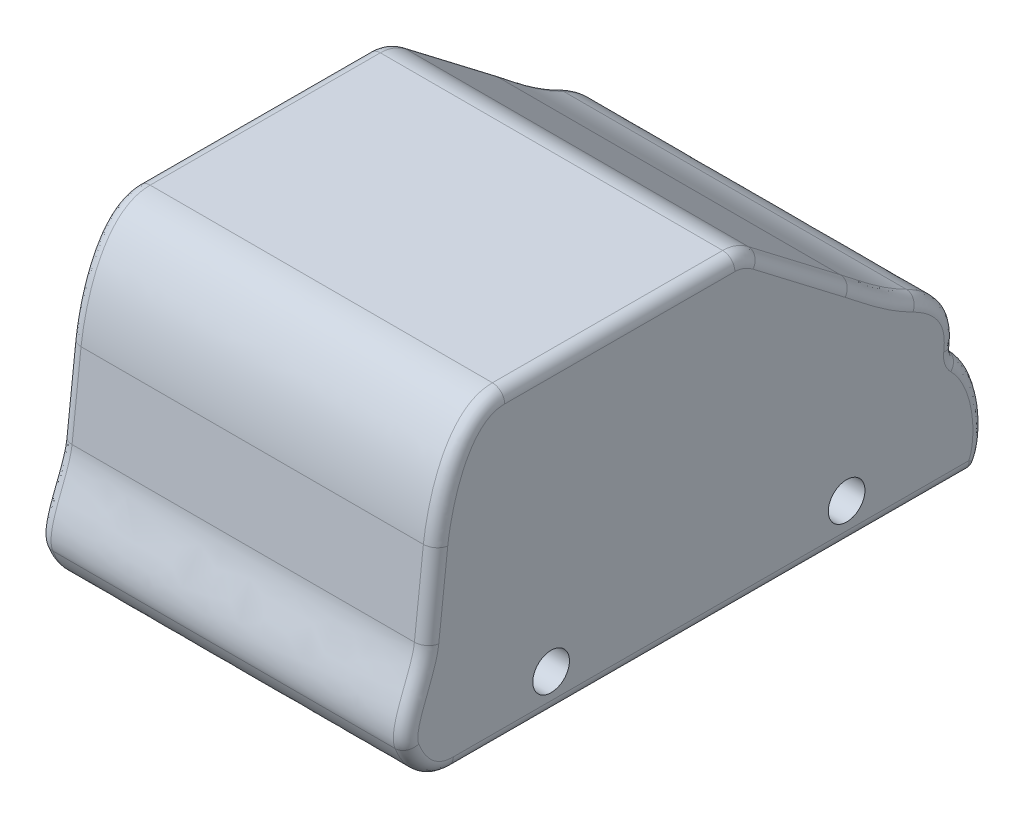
SolidWorks part; units mm, degrees
ref_plane "Front Plane" through (0, 0, 0) normal (0, 0, 1) x (1, 0, 0)
ref_plane "Top Plane" through (0, 0, 0) normal (0, 1, 0) x (1, 0, 0)
ref_plane "Right Plane" through (0, 0, 0) normal (1, 0, 0) x (0, 0, -1)
sketch "Sketch1" plane through (0, 0, 0) normal (1, 0, 0) x (0, 0, -1)
  line L0 (11.4886, 18.3693) -> (3.9521, 24.1357)
  line L1 (1.8606, 24.9086) -> (-16.9703, 24.951)
  line L2 (-22.6194, 16.3301) -> (-23.3533, 9.7689)
  line L3 (-21.1737, 0.0488) -> (21.1737, -0.0488)
  circle A0 centre (10.9999, 3.1028) radius 1.5
  circle A1 centre (-13.1699, 3.1028) radius 1.5
  ellipse E0 centre (-13.1699, 3.1028) end of major axis (-14.6699, 3.1028) minor radius 1.5 construction
  ellipse E1 centre (10.9999, 3.1028) end of major axis (9.4999, 3.1028) minor radius 1.5 construction
  ellipse E2 centre (-19.7762, 13.8426) end of major axis (-20.9613, 13.8426) minor radius 1.1851 construction
  spline S0 degree 3 poles (16.8773, 14.6517) (14.6974, 15.7501) (13.1976, 17.0617) (11.4886, 18.3693) knots 0 0 0 0 0.083333 0.083333 0.083333 0.083333
  spline S1 degree 3 poles (3.9521, 24.1357) (3.3953, 24.5617) (2.6712, 24.9068) (1.8606, 24.9086) knots 0.166667 0.166667 0.166667 0.166667 0.25 0.25 0.25 0.25
  spline S2 degree 3 poles (-16.9703, 24.951) (-21.1683, 24.951) (-22.4117, 18.1859) (-22.6194, 16.3301) knots 0.333333 0.333333 0.333333 0.333333 0.416667 0.416667 0.416667 0.416667
  spline S3 degree 3 poles (-23.3533, 9.7689) (-23.5851, 7.6972) (-25.6173, 4.7746) (-24.9324, 3.0224) knots 0.5 0.5 0.5 0.5 0.583333 0.583333 0.583333 0.583333
  spline S4 degree 3 poles (-24.9324, 3.0224) (-24.2181, 1.1955) (-22.9756, 0.0529) (-21.1737, 0.0488) knots 0.583333 0.583333 0.583333 0.583333 0.666667 0.666667 0.666667 0.666667
  spline S5 degree 3 poles (21.1737, -0.0488) (22.6583, -0.0518) (23.0745, 5.866) (20.2215, 8.7003) knots 0.75 0.75 0.75 0.75 0.833333 0.833333 0.833333 0.833333
  spline S6 degree 3 poles (20.2215, 8.7003) (19.9937, 8.9267) (19.8935, 9.2185) (19.9345, 9.5371) knots 0.833333 0.833333 0.833333 0.833333 0.916667 0.916667 0.916667 0.916667
  spline S7 degree 3 poles (19.9345, 9.5371) (20.1513, 11.2271) (19.8046, 13.1768) (16.8773, 14.6517) knots 0.916667 0.916667 0.916667 0.916667 1 1 1 1
extrude "Boss-Extrude1" add sketch "Sketch1" along normal mid plane 30 contours E2 | S6 S7 S0 L0 S1 L1 S2 L2 S3 S4 L3 S5 E0 E1 E2
fillet "Fillet1" radius 1 22 edges at (15, 13.0495, 22.9864) (15, 0, 0) (15, 24.9298, 7.5549) (15, 21.2525, -7.7204) (-15, 13.0495, 22.9864) (-15, 0, 0) (-15, 21.2525, -7.7204) (-15, 24.9298, 7.5549)
